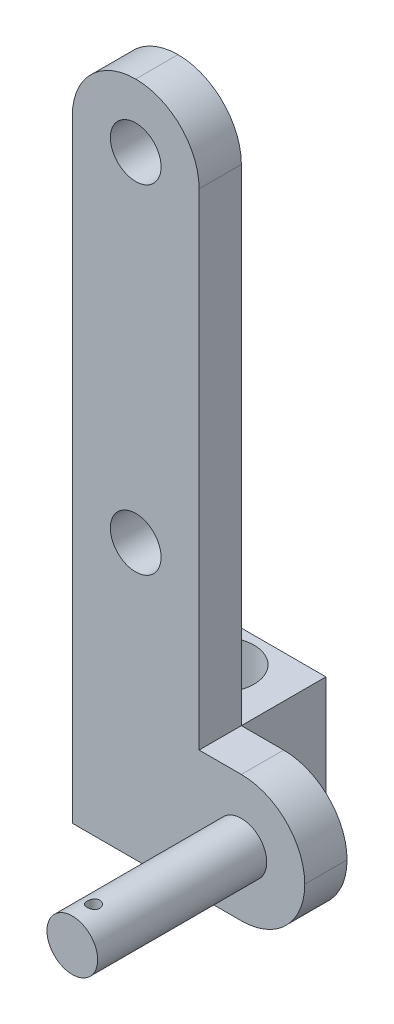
SolidWorks part; units mm, degrees
ref_plane "Plan de face" through (0, 0, 0) normal (0, 0, 1) x (1, 0, 0)
ref_plane "Plan de dessus" through (0, 0, 0) normal (0, 1, 0) x (1, 0, 0)
ref_plane "Plan de droite" through (0, 0, 0) normal (1, 0, 0) x (0, 0, -1)
sketch "Esquisse1" plane through (0, 0, 0) normal (0, 0, 1) x (1, 0, 0)
  line L0 (25, -160) -> (-30, -160)
  line L1 (0, 0) -> (0, -130)
  line L2 (0, 0) -> (-30, 0)
  line L3 (-30, 0) -> (-30, -160)
  line L4 (0, -130) -> (25, -130)
  line L5 (25, -160) -> (25, -130)
  dimension "D5" = 25
  dimension "D1" = 160
  dimension "D2" = 130
  dimension "D3" = 55
  dimension "D4" = 30
extrude "Extrusion1" add sketch "Esquisse1" along normal blind 10
sketch "Esquisse2" plane through (0, 0, 10) normal (0, 0, 1) x (1, 0, 0)
  circle A0 centre (10, -145) radius 6
  dimension "D1" = 12
  dimension "D3" = 15
  dimension "D2" = 15
extrude "Extrusion2" add sketch "Esquisse2" along normal blind 40
sketch "Esquisse3" plane through (0, 0, 0) normal (0, 0, -1) x (-1, 0, 0)
  line L0 (0, -130) -> (0, -160)
  line L1 (-25, -130) -> (0, -130) construction
  line L2 (0, -130) -> (0, 0) construction
  line L3 (30, -160) -> (-25, -160) construction
  line L4 (0, -160) -> (30, -160)
  line L5 (30, -160) -> (30, -130)
  line L6 (30, 0) -> (30, -160) construction
  line L7 (30, -130) -> (0, -130)
extrude "Extrusion3" add sketch "Esquisse3" along normal blind 20
sketch "Esquisse4" plane through (0, -130, 0) normal (0, 1, 0) x (1, 0, 0)
  line L0 (-30, 20) -> (-30, 0) construction
  line L1 (-30, 0) -> (0, 0) construction
  circle A0 centre (-15, 10) radius 8
  dimension "D1" = 16
  dimension "D2" = 15
  dimension "D3" = 10
extrude "Enlèv. mat.-Extru.1" cut sketch "Esquisse4" against normal through all
sketch "Esquisse5" plane through (0, 0, 10) normal (0, 0, 1) x (1, 0, 0)
  line L2 (0, -130) -> (0, 0) construction
  circle A0 centre (-15, -15) radius 6
  circle A1 centre (-15, -95) radius 6
  dimension "D1" = 12
  dimension "D2" = 15
  dimension "D3" = 15
  dimension "D4" = 80
  dimension "D5" = 15
extrude "Enlèv. mat.-Extru.2" cut sketch "Esquisse5" against normal through all
fillet "Congé1" radius 15 4 edges at (25, -160, 5) (25, -130, 5) (-30, 0, 5) (0, 0, 5)
sketch "Esquisse6" plane through (0, 0, 0) normal (0, 1, 0) x (1, 0, 0)
  line L0 (4, -50) -> (16, -50) construction
  circle A0 centre (10, -45) radius 1.5
  dimension "D1" = 5
extrude "Enlèv. mat.-Extru.3" cut sketch "Esquisse6" against normal through all
